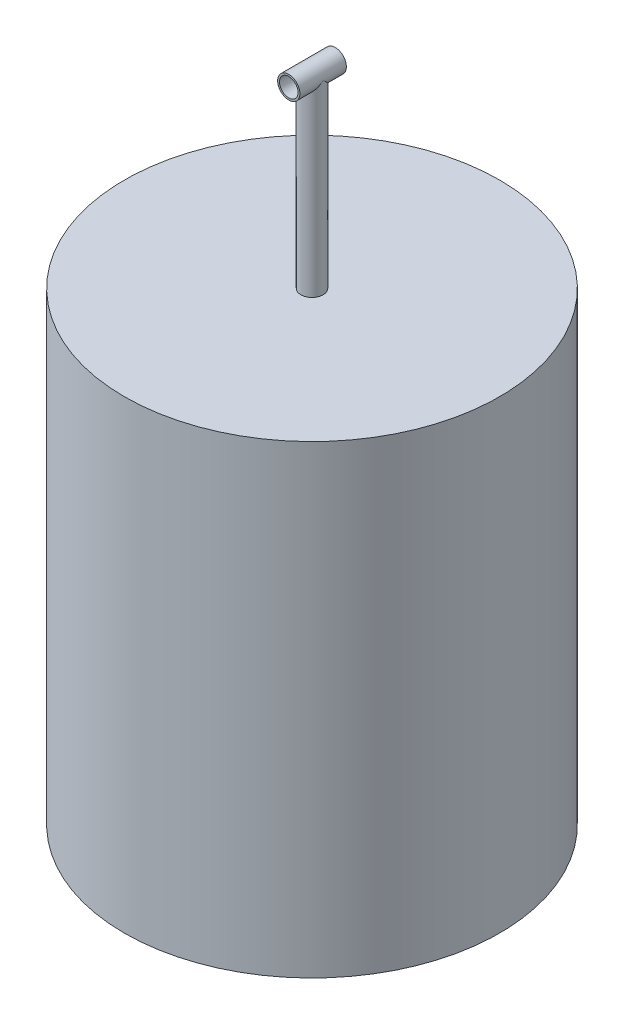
SolidWorks part; units mm, degrees
ref_plane "Plan de face" through (0, 0, 0) normal (0, 0, 1) x (1, 0, 0)
ref_plane "Plan de dessus" through (0, 0, 0) normal (0, 1, 0) x (1, 0, 0)
ref_plane "Plan de droite" through (0, 0, 0) normal (1, 0, 0) x (0, 0, -1)
sketch "Esquisse2" plane through (0, 0, 0) normal (0, 1, 0) x (1, 0, 0)
  circle A0 centre (0, 0) radius 201.95
  dimension "D1" = 403.9
extrude "Extrusion2" add sketch "Esquisse2" against normal blind 500
sketch "Esquisse4" plane through (0, 0, 0) normal (0, 0, 1) x (1, 0, 0)
  line L0 (0, -222.1835) -> (0, 222.1835) construction
  circle A0 centre (0, 200) radius 10
  dimension "D1" = 20
  dimension "D2" = 200
extrude "Extru.-Mince2" add sketch "Esquisse4" along normal mid plane 50 thin
sketch "Esquisse3" plane through (0, 0, 0) normal (0, 1, 0) x (-1, 0, 0)
  circle A0 centre (0, 0) radius 10
  dimension "D1" = 20
extrude "Extru.-Mince1" add sketch "Esquisse3" along normal up to surface (200 mm away) thin
